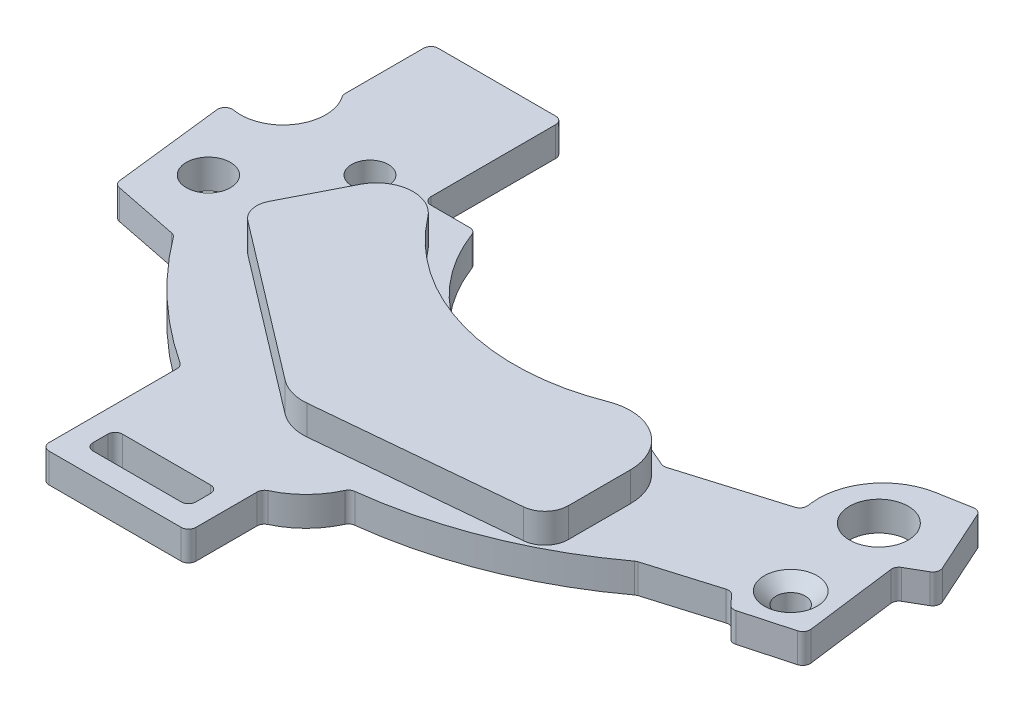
SolidWorks part; units mm, degrees
ref_plane "Front Plane" through (0, 0, 0) normal (0, 0, 1) x (1, 0, 0)
ref_plane "Top Plane" through (0, 0, 0) normal (0, 1, 0) x (1, 0, 0)
ref_plane "Right Plane" through (0, 0, 0) normal (1, 0, 0) x (0, 0, -1)
sketch "Sketch1" plane through (0, 0, 0) normal (0, 1, 0) x (1, 0, 0)
  line L1 (-52, 42) -> (-44, 42)
  line L7 (-43.5, 41.5) -> (-43.5, 33)
  line L23 (-55.9117, 30.8404) -> (-55.042, 23.3612)
  line L30 (-54.6434, 22.9287) -> (-50.1881, 22.0376)
  line L31 (-42, 14.229) -> (-42, 5.5)
  line L32 (-41.5, 5) -> (-32.5, 5)
  line L33 (-32, 5.5) -> (-32, 9.6712)
  line L34 (-14.9159, 18.5252) -> (-10.3017, 19.9095)
  line L35 (-9.7881, 19.7669) -> (-9.2065, 19.1272)
  line L36 (-8.704, 18.9814) -> (-5.4187, 19.8849)
  line L37 (-5.8576, 26.6702) -> (-5.0554, 20.4307)
  line L38 (-5.6122, 27.1666) -> (-4.391, 27.8736)
  line L39 (-4.1858, 28.5119) -> (-6.1398, 32.8447)
  line L40 (-8.8921, 32.7358) -> (-6.6837, 33.1313)
  line L41 (-12.4524, 27.6189) -> (-12.4824, 27.8589)
  line L42 (-19.5245, 25.0529) -> (-12.8042, 27.0782)
  line L43 (-19.8681, 25.0731) -> (-21.0944, 25.6063)
  line L44 (-43, 32.5) -> (-40.3512, 32.5)
  line L45 (-52.5, 41.5) -> (-52.5, 36.1613)
  arc A21 (-52.4129, 35.8792) -> (-55.3257, 31.3901) centre (-54.8075, 34.2435) cw
  arc A22 (-49.8863, 21.8474) -> (-42.2252, 14.6467) centre (-25.4056, 40.2174) ccw
  arc A23 (-31.7113, 10.1244) -> (-29.1092, 12.7443) centre (-33.9709, 14.9709) ccw
  arc A24 (-28.7136, 13.0326) -> (-15.0698, 18.4481) centre (-32.0885, 41.4297) ccw
  arc A25 (-39.8833, 32.1761) -> (-22.7999, 25.5541) centre (-28.3803, 36.5046) ccw
  arc A26 (-40.3512, 32.5) -> (-39.8833, 32.1761) centre (-40.3512, 32) cw
  arc A29 (-19.8681, 25.0731) -> (-19.5245, 25.0529) centre (-19.6688, 25.5316) ccw
  arc A30 (-14.9159, 18.5252) -> (-15.0698, 18.4481) centre (-14.7723, 18.0463) ccw
  arc A31 (-28.7136, 13.0326) -> (-29.1092, 12.7443) centre (-28.6546, 12.5361) ccw
  arc A32 (-32, 9.6712) -> (-31.7113, 10.1244) centre (-31.5, 9.6712) cw
  arc A33 (-50.1881, 22.0376) -> (-49.8863, 21.8474) centre (-50.2862, 21.5473) cw
  arc A34 (-55.042, 23.3612) -> (-54.6434, 22.9287) centre (-54.5453, 23.419) ccw
  arc A35 (-55.3257, 31.3901) -> (-55.9117, 30.8404) centre (-55.415, 30.8982) ccw
  arc A36 (-52.5, 36.1613) -> (-52.4129, 35.8792) centre (-52, 36.1613) ccw
  arc A37 (-42.2252, 14.6467) -> (-42, 14.229) centre (-42.5, 14.229) cw
  arc A38 (-42, 5.5) -> (-41.5, 5) centre (-41.5, 5.5) ccw
  arc A39 (-32.5, 5) -> (-32, 5.5) centre (-32.5, 5.5) ccw
  arc A40 (-10.3017, 19.9095) -> (-9.7881, 19.7669) centre (-10.1581, 19.4306) cw
  arc A41 (-9.2065, 19.1272) -> (-8.704, 18.9814) centre (-8.8366, 19.4635) ccw
  arc A42 (-5.0554, 20.4307) -> (-5.4187, 19.8849) centre (-5.5513, 20.367) cw
  arc A43 (-5.8576, 26.6702) -> (-5.6122, 27.1666) centre (-5.3617, 26.7339) cw
  arc A44 (-4.391, 27.8736) -> (-4.1858, 28.5119) centre (-4.6415, 28.3063) ccw
  arc A45 (-6.1398, 32.8447) -> (-6.6837, 33.1313) centre (-6.5955, 32.6391) ccw
  arc A46 (-12.4524, 27.6189) -> (-12.8042, 27.0782) centre (-12.9485, 27.5569) cw
  arc A47 (-43.5, 33) -> (-43, 32.5) centre (-43, 33) ccw
  arc A48 (-44, 42) -> (-43.5, 41.5) centre (-44, 41.5) cw
  arc A49 (-52.5, 41.5) -> (-52, 42) centre (-52, 41.5) cw
  arc A50 (-8.8921, 32.7358) -> (-12.4824, 27.8589) centre (-8.1163, 28.4047) ccw
  arc A51 (-21.0944, 25.6063) -> (-22.7999, 25.5541) centre (-21.8918, 23.7721) ccw
  point P0 (-56, 31.6)
  point P1 (-55, 23)
  point P2 (-50, 22)
  point P3 (-42, 14.5)
  point P16 (-29, 13)
  point P22 (-15, 18.5)
  point P25 (-40, 32.5)
  point P28 (-10, 20)
  point P29 (-9, 18.9)
  point P31 (-5, 20)
  point P33 (-5.9, 27)
  point P36 (-4, 28.1)
  point P37 (-4, 28.1)
  point P38 (-6.3, 33.2)
  point P40 (-13, 32)
  point P43 (-12.4, 27.2)
  point P45 (-19.7, 25)
  point P47 (-22, 26)
  point P53 (-22, 26)
  point P55 (-13, 32)
  point P56 (-13, 32)
  point P59 (-19.7, 25)
  point P62 (-15, 18.5)
  point P66 (-29, 13)
  point P69 (-32, 10)
  point P73 (-50, 22)
  point P76 (-55, 23)
  point P79 (-56, 31.6)
  point P82 (-52.5, 36)
  point P85 (-42, 14.5)
  point P88 (-42, 5)
  point P91 (-32, 5)
  point P94 (-10, 20)
  point P97 (-9, 18.9)
  point P100 (-5, 20)
  point P103 (-5.9, 27)
  point P106 (-4, 28.1)
  point P109 (-6.3, 33.2)
  point P112 (-12.4, 27.2)
  point P115 (-43.5, 32.5)
  point P123 (-22, 26)
  dimension "D5" = 6
  dimension "D12" = 2.9
  dimension "D13" = 3.5
  dimension "D15" = 14
  dimension "D16" = 56
  dimension "D17" = 27
  dimension "D18" = 10
  dimension "D10" = 37
  dimension "D19" = 5
  dimension "D11" = 1
  dimension "D20" = 41
  dimension "D21" = 46
  dimension "D9" = 27.5
  dimension "D45" = 0.5
  dimension "D46" = 4.4
  dimension "D47" = 2
  dimension "D2" = 10.4
  dimension "D3" = 9.5
  dimension "D6" = 31.6
  dimension "D7" = 19
  dimension "D8" = 20
  dimension "D14" = 6
  dimension "D22" = 47
  dimension "D23" = 51
  dimension "D24" = 0.9
  dimension "D25" = 1.9
  dimension "D26" = 49.7
  dimension "D27" = 43
  dimension "D28" = 0.6
  dimension "D29" = 36.3
  dimension "D30" = 2.3
  dimension "D31" = 16
  dimension "D32" = 12.5
  dimension "D33" = 16
  dimension "D34" = 17
  dimension "D35" = 14.8
  dimension "D36" = 10
  dimension "D37" = 8.8
  dimension "D38" = 5.1
  dimension "D39" = 1.1
  dimension "D40" = 7
  dimension "D41" = 1.1
  dimension "D42" = 1.1
  dimension "D43" = 1.5
  dimension "D44" = 5.5
extrude "Boss-Extrude1" add sketch "Sketch1" along normal blind 2
sketch "Sketch2" plane through (0, 2, 0) normal (0, 1, 0) x (1, 0, 0)
  line L1 (-43.5, 33) -> (-43.5, 41.5) construction
  line L2 (-40.3512, 32.5) -> (-43, 32.5) construction
  line L3 (-18.6, 21.6864) -> (-18.6, 17.4579)
  line L4 (-33.5346, 14.6086) -> (-20.0516, 15.8648)
  line L5 (-35.631, 15.2093) -> (-46.3033, 23.3406)
  line L6 (-46.7302, 25.2159) -> (-44.6291, 29.3306)
  arc A1 (-40.4139, 29.7087) -> (-23.3796, 24.9441) centre (-28.7436, 38.5996) ccw
  arc A2 (-44.6291, 29.3306) -> (-40.4139, 29.7087) centre (-42.4025, 28.1936) cw
  arc A3 (-18.6, 21.6864) -> (-23.3796, 24.9441) centre (-22.1, 21.6864) ccw
  arc A4 (-20.0516, 15.8648) -> (-18.6, 17.4579) centre (-20.2, 17.4579) ccw
  arc A5 (-35.631, 15.2093) -> (-33.5346, 14.6086) centre (-33.8129, 17.5956) ccw
  arc A6 (-46.7302, 25.2159) -> (-46.3033, 23.3406) centre (-45.3943, 24.5338) ccw
  point P0 (-42.5, 33.5)
  point P1 (-42.5, 33.5)
  point P5 (-18.6, 28)
  point P10 (-34.7, 14.5)
  point P13 (-47.3, 24.1)
  point P17 (-42.5, 33.5)
  point P20 (-18.6, 28)
  point P23 (-18.6, 16)
  point P26 (-34.7, 14.5)
  point P29 (-47.3, 24.1)
  dimension "D10" = 2.5
  dimension "D11" = 3.5
  dimension "D12" = 1.6
  dimension "D13" = 3
  dimension "D14" = 1.5
  dimension "D1" = 1
  dimension "D2" = 5.5
  dimension "D3" = 1
  dimension "D4" = 23.9
  dimension "D5" = 12
  dimension "D6" = 16.1
  dimension "D7" = 1.5
  dimension "D8" = 12.6
  dimension "D9" = 9.6
extrude "Boss-Extrude2" add sketch "Sketch2" along normal blind 2
sketch "Sketch3" plane through (0, 2, 0) normal (0, 1, 0) x (1, 0, 0)
  line L0 (-43.5, 33) -> (-43.5, 41.5) construction
  line L1 (-41.5, 5) -> (-32.5, 5) construction
  line L2 (-42, 14.229) -> (-42, 5.5) construction
  line L3 (-40, 8.5) -> (-34, 8.5)
  line L4 (-40.5, 8) -> (-40.5, 7)
  line L5 (-40, 6.5) -> (-34, 6.5)
  line L6 (-33.5, 8) -> (-33.5, 7)
  line L7 (-32, 5.5) -> (-32, 9.6712) construction
  circle A0 centre (-9, 29) radius 2
  circle A1 centre (-52.35, 26.7) radius 1.5
  circle A2 centre (-8, 22) radius 1
  circle A3 centre (-46.85, 32.2) radius 1.25
  arc A4 (-40, 8.5) -> (-40.5, 8) centre (-40, 8) ccw
  arc A5 (-40.5, 7) -> (-40, 6.5) centre (-40, 7) ccw
  arc A6 (-34, 6.5) -> (-33.5, 7) centre (-34, 7) ccw
  arc A7 (-34, 8.5) -> (-33.5, 8) centre (-34, 8) cw
  dimension "D2" = 4
  dimension "D6" = 3
  dimension "D9" = 2
  dimension "D12" = 2.5
  dimension "D17" = 0.5
  dimension "D1" = 34.5
  dimension "D3" = 24
  dimension "D4" = 8.85
  dimension "D5" = 21.7
  dimension "D7" = 7
  dimension "D8" = 1
  dimension "D10" = 5.5
  dimension "D11" = 5.5
  dimension "D13" = 1.5
  dimension "D14" = 1.5
  dimension "D15" = 1.5
  dimension "D16" = 2
extrude "Cut-Extrude1" cut sketch "Sketch3" against normal blind 2
chamfer "Chamfer1" distance 0.8 1 edges at (-8, 2, -21)
